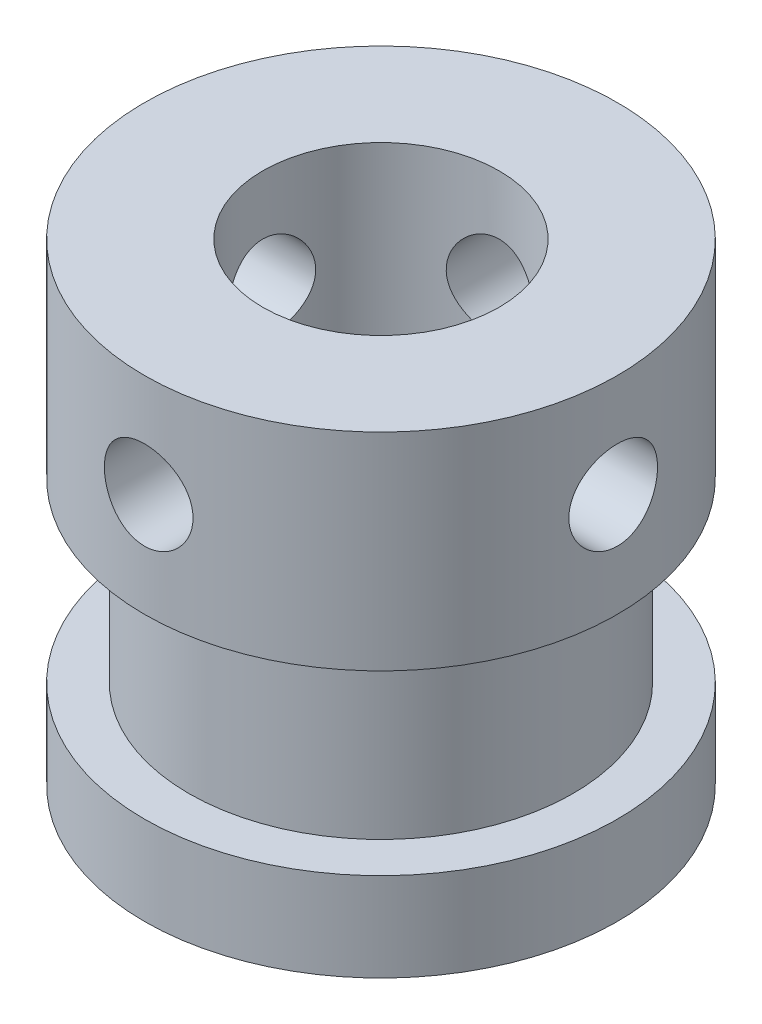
SolidWorks part; units mm, degrees
ref_plane "前视基准面" through (0, 0, 0) normal (0, 0, 1) x (1, 0, 0)
ref_plane "上视基准面" through (0, 0, 0) normal (0, 1, 0) x (1, 0, 0)
ref_plane "右视基准面" through (0, 0, 0) normal (1, 0, 0) x (0, 0, -1)
other "Configuration Table"
sketch "草图1" plane through (0, 0, 0) normal (0, 1, 0) x (1, 0, 0)
  circle A0 centre (0, 0) radius 8
  dimension "D1" = 16
extrude "凸台-拉伸1" add sketch "草图1" along normal blind 16
sketch "草图2" plane through (0, 16, 0) normal (0, 1, 0) x (1, 0, 0)
  circle A0 centre (0, 0) radius 4
  dimension "D1" = 8
extrude "切除-拉伸1" cut sketch "草图2" against normal through all
ref_plane "基准面1" through (0, 3, 0) normal (0, 1, 0) x (1, 0, 0)
sketch "草图3" plane through (0, 3, 0) normal (0, 1, 0) x (1, 0, 0)
  circle A0 centre (0, 0) radius 6.5
  dimension "D1" = 13
extrude "切除-拉伸2" cut sketch "草图3" along normal blind 6 flip side to cut
sketch "草图4" plane through (0, 0, 0) normal (1, 0, 0) x (0, 0, -1)
  line L0 (0, 8.8) -> (0, -8.8) construction
  line L1 (4, 16) -> (-4, 16) construction
  circle A0 centre (0, 12.5) radius 1.5
  dimension "D1" = 3
  dimension "D2" = 3.5
extrude "切除-拉伸3" cut sketch "草图4" against normal through all and the other way through all
sketch "草图5" plane through (0, 0, 0) normal (0, 0, 1) x (1, 0, 0)
  line L0 (0, -8.8) -> (0, 8.8) construction
  line L1 (8, 16) -> (-8, 16) construction
  circle A0 centre (0, 12.5) radius 1.5
  dimension "D1" = 3
  dimension "D2" = 3.5
extrude "切除-拉伸4" cut sketch "草图5" against normal through all and the other way through all
